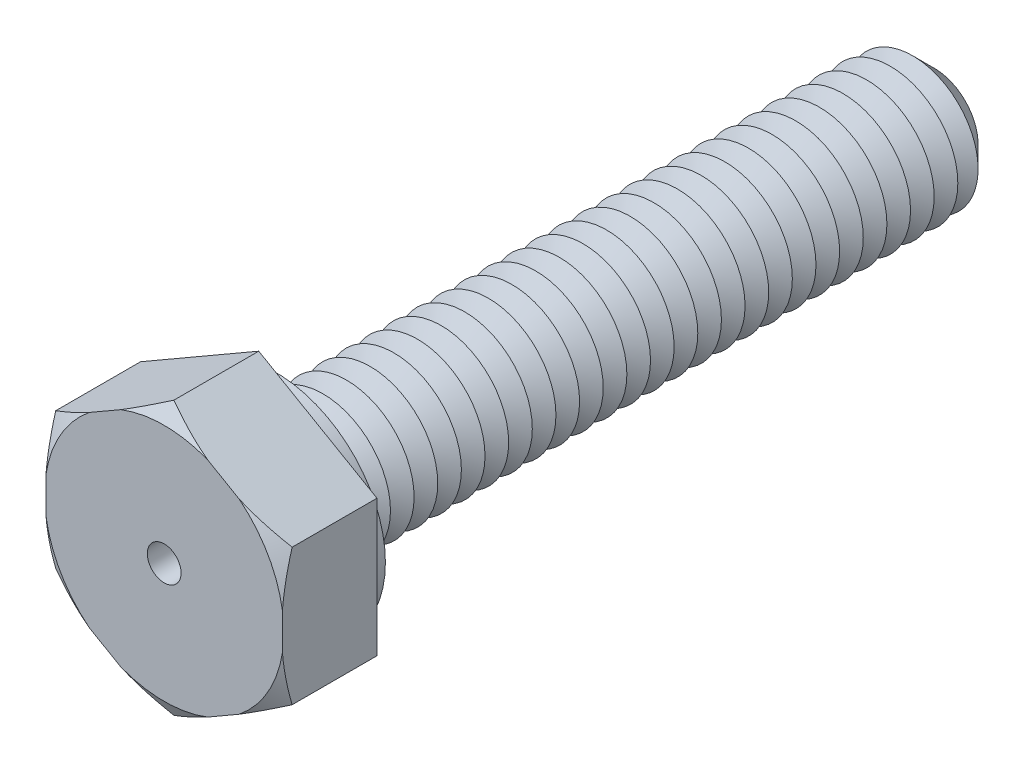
SolidWorks part; units mm, degrees
ref_plane "Front Plane" through (0, 0, 0) normal (0, 0, 1) x (1, 0, 0)
ref_plane "Top Plane" through (0, 0, 0) normal (0, 1, 0) x (1, 0, 0)
ref_plane "Right Plane" through (0, 0, 0) normal (1, 0, 0) x (0, 0, -1)
sketch "Sketch2" plane through (0, 0, 0) normal (0, 0, 1) x (1, 0, 0)
  line L1 (0, 4.0415) -> (-3.5, 2.0207)
  line L2 (-3.5, 2.0207) -> (-3.5, -2.0207)
  line L3 (-3.5, -2.0207) -> (0, -4.0415)
  line L4 (0, -4.0415) -> (3.5, -2.0207)
  line L5 (3.5, -2.0207) -> (3.5, 2.0207)
  line L6 (3.5, 2.0207) -> (0, 4.0415)
  circle A0 centre (0, 0) radius 3.5 construction
  dimension "D1" = 7
extrude "Boss-Extrude1" add sketch "Sketch2" along normal blind 2.8
sketch "Sketch3" plane through (0, 0, 0) normal (0, 0, -1) x (-1, 0, 0)
  circle A0 centre (0, 0) radius 2
  dimension "D1" = 4
extrude "Boss-Extrude2" add sketch "Sketch3" along normal blind 20
sketch "Sketch4" plane through (0, 0, 0) normal (0, 0, -1) x (-1, 0, 0)
  circle A0 centre (0, 0) radius 3.25
  dimension "D1" = 6.5
extrude "Boss-Extrude3" add sketch "Sketch4" along normal blind 0.5
sketch "Sketch5" plane through (0, 0, 0) normal (1, 0, 0) x (0, 0, -1)
  line L0 (-3.2117, 0) -> (6.3192, 0) construction
chamfer "Chamfer1" distance 0.7 angle 45 1 edges at (-2, 0, -20)
sketch "Sketch6" plane through (0, 0, 0) normal (1, 0, 0) x (0, 0, -1)
  line L0 (0.5, 2) -> (0.85, 1.3938)
  line L1 (0.85, 1.3938) -> (1.2, 2)
  line L2 (19.3, 2) -> (0.5, 2) construction
  line L3 (1.2, 2) -> (0.5, 2)
  dimension "D1" = 0.7
revolve "Cut-Revolve1" cut sketch "Sketch6" angle 360 about L0
pattern_linear "LPattern1" count 27 spacing 0.7 along (0, 0, -1) of "Cut-Revolve1"
sketch "Sketch7" plane through (0, 0, 0) normal (1, 0, 0) x (0, 0, -1)
  line L0 (-2.8, 4.0415) -> (-2.8, 3.5415)
  line L1 (-2.8, 2.0207) -> (-2.8, 4.0415) construction
  line L2 (-2.8, 3.5415) -> (-2.5113, 4.0415)
  line L3 (-2.8, 4.0415) -> (0, 4.0415) construction
  line L4 (-2.5113, 4.0415) -> (-2.8, 4.0415)
  dimension "D1" = 0.5
  dimension "D2" = 30
revolve "Cut-Revolve2" cut sketch "Sketch7" angle 360 about L0
sketch "Sketch8" plane through (0, 0, 2.8) normal (0, 0, 1) x (1, 0, 0)
  circle A0 centre (0, 0) radius 0.5
  dimension "D1" = 1
extrude "Cut-Extrude1" cut sketch "Sketch8" against normal up to surface (22.8 mm away)
